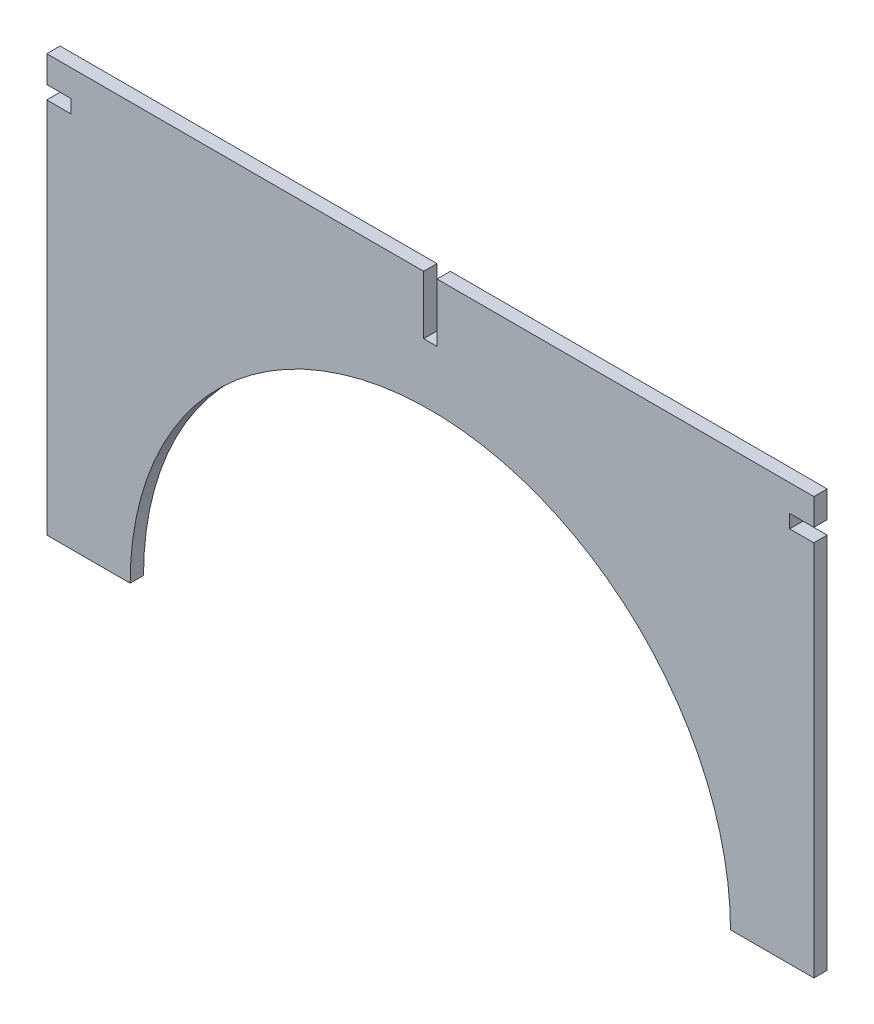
SolidWorks part; units mm, degrees
ref_plane "Front Plane" through (0, 0, 0) normal (0, 0, 1) x (1, 0, 0)
ref_plane "Top Plane" through (0, 0, 0) normal (0, 1, 0) x (1, 0, 0)
ref_plane "Right Plane" through (0, 0, 0) normal (1, 0, 0) x (0, 0, -1)
sketch "Sketch2" plane through (0, 0, 0) normal (0, 0, 1) x (1, 0, 0)
  line L0 (-329.0738, -360) -> (-429.0738, -360)
  line L1 (490.9262, 140) -> (-429.0738, 140)
  line L2 (490.9262, 140) -> (490.9262, -360)
  line L3 (490.9262, -360) -> (390.9262, -360)
  line L4 (-429.0738, 140) -> (-429.0738, -360)
  line L6 (22.9262, 70) -> (38.9262, 70)
  line L7 (22.9262, 70) -> (22.9262, 140)
  line L9 (38.9262, 70) -> (38.9262, 140)
  arc A0 (390.9262, -360) -> (-329.0738, -360) centre (30.9262, -360) ccw
  point P0 (0, 0)
  point P8 (30.9262, 140)
  point P10 (30.9262, 140)
extrude "Boss-Extrude1" add sketch "Sketch2" along normal blind 16 contours A0 L3 L2 L1 L9 L6 L7 L4 L0
sketch "Sketch3" plane through (0, 0, 0) normal (0, 0, 1) x (1, 0, 0)
  line L0 (-429.0738, 140) -> (-429.0738, -360) construction
  line L1 (-429.0738, 108) -> (-400.0738, 108)
  line L2 (-429.0738, 108) -> (-429.0738, 92)
  line L3 (-429.0738, 92) -> (-400.0738, 92)
  line L4 (-400.0738, 108) -> (-400.0738, 92)
  line L5 (22.9262, 140) -> (-429.0738, 140) construction
  line L6 (490.9262, 140) -> (38.9262, 140) construction
  line L7 (490.9262, 108) -> (461.9262, 108)
  line L8 (490.9262, 108) -> (490.9262, 92)
  line L9 (490.9262, 92) -> (461.9262, 92)
  line L10 (461.9262, 108) -> (461.9262, 92)
  line L13 (490.9262, 140) -> (490.9262, -360) construction
  point P0 (-421.0738, 116)
  point P5 (482.9262, 116)
  dimension "D1" = 0
  dimension "D2" = 29
  dimension "D3" = 16
  dimension "D4" = 0
  dimension "D5" = 16
  dimension "D6" = 29
  dimension "D7" = 32
  dimension "D8" = 32
extrude "Cut-Extrude9" cut sketch "Sketch3" along normal blind 16
equation "\"thicknes\"= 16mm"
equation "\"press\"= 16mm"
equation "\"D6@Sketch2\"=\"press\""
equation "\"D1@Boss-Extrude1\"=\"thicknes\""
equation "\"D1@Cut-Extrude9\"=\"thicknes\""
